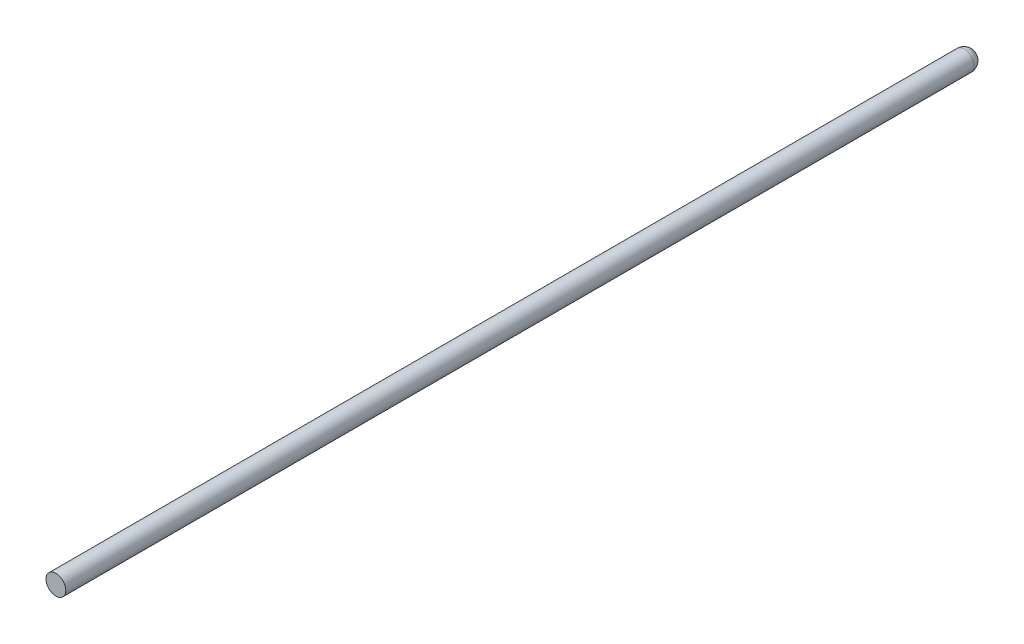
SolidWorks part; units mm, degrees
ref_plane "Plan de face" through (0, 0, 0) normal (0, 0, 1) x (1, 0, 0)
ref_plane "Plan de dessus" through (0, 0, 0) normal (0, 1, 0) x (1, 0, 0)
ref_plane "Plan de droite" through (0, 0, 0) normal (1, 0, 0) x (0, 0, -1)
sketch "Esquisse1" plane through (0, 0, 0) normal (0, 0, 1) x (1, 0, 0)
  circle A0 centre (0, 0) radius 7
  dimension "D1" = 14
extrude "Boss.-Extru.1" add sketch "Esquisse1" along normal blind 650
fillet "Congé1" radius 7 1 edges at (7, 0, 0)
